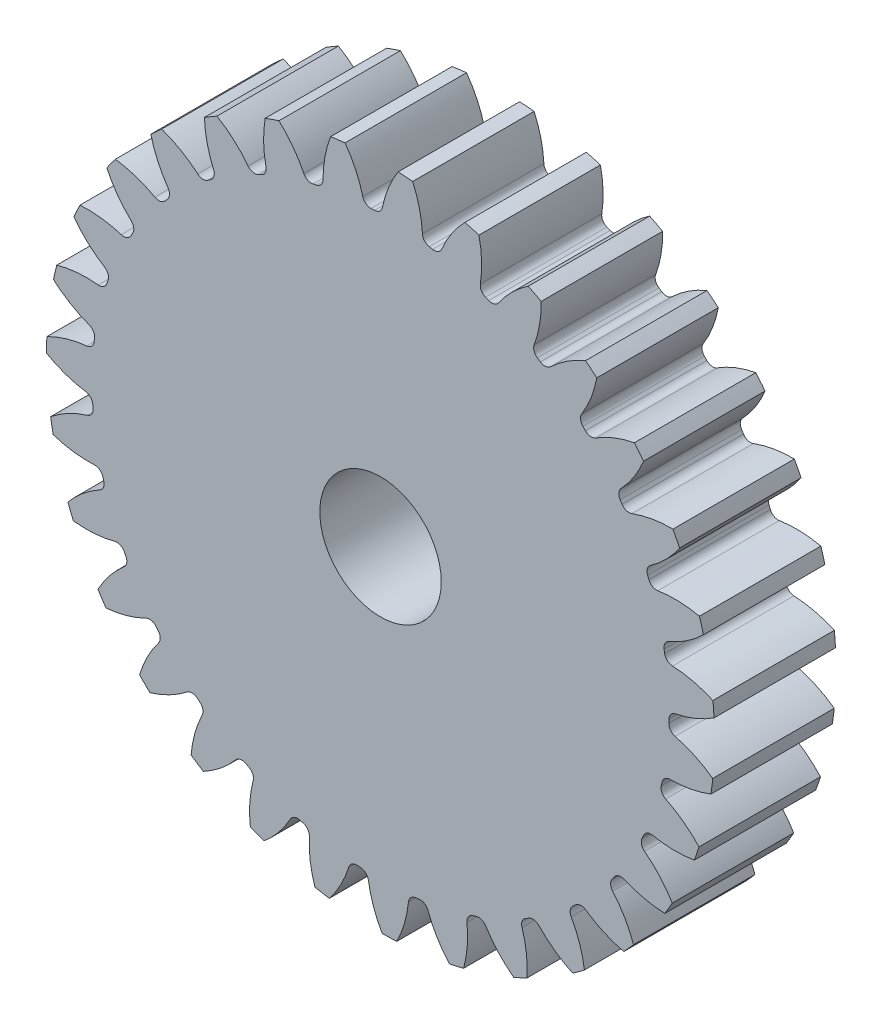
SolidWorks part; units mm, degrees
ref_plane "Front" through (0, 0, 0) normal (0, 0, 1) x (1, 0, 0)
ref_plane "Top" through (0, 0, 0) normal (0, 1, 0) x (1, 0, 0)
ref_plane "Right" through (0, 0, 0) normal (1, 0, 0) x (0, 0, -1)
sketch "Sketch3" plane through (0, 0, 0) normal (0, 0, 1) x (1, 0, 0)
  circle A0 centre (0, 0) radius 279.4
  dimension "od" = 558.8
extrude "gearBody" add sketch "Sketch3" along normal blind 101.6
sketch "Sketch2" plane through (0, 0, 0) normal (0, 0, 1) x (1, 0, 0)
  line L0 (0, 0) -> (227.8638, 94.3843) construction
  line L1 (278.3276, -29.1273) -> (0, 0) construction
  line L2 (0, 0) -> (36.3143, 0) construction
  line L3 (262.3735, 6.9922) -> (261.7415, -19.4974) construction
  line L5 (262.0575, -6.2526) -> (0, 0) construction
  line L7 (0, 0) -> (246.638, 0) construction
  arc A0 (246.6271, 2.3178) -> (246.2359, -14.0773) centre (0, 0) ccw construction
  arc A1 (278.9676, 15.5382) -> (277.9091, -28.8251) centre (0, 0) ccw construction
  arc A2 (262.3735, 6.9922) -> (261.7415, -19.4974) centre (0, 0) ccw construction
  arc A3 (241.1917, -7.2288) -> (241.262, -4.2824) centre (0, 0) ccw
  arc A4 (278.3276, -29.1273) -> (246.3736, -14.1124) centre (223.1031, -105.1442) ccw
  arc A5 (278.3276, -29.1273) -> (279.4, 15.8202) centre (0, 0) ccw
  arc A6 (279.4, 15.8202) -> (246.7663, 2.3463) centre (227.8638, 94.3843) cw
  arc A7 (241.262, -4.2824) -> (246.7663, 2.3463) centre (248.1528, -4.4047) cw
  arc A8 (246.3736, -14.1124) -> (241.1917, -7.2288) centre (248.0805, -7.4353) cw
  point P6 (279.4, 15.8202)
  point P22 (278.3276, -29.1273)
  dimension "baseDia" = 493.276
  dimension "od" = 558.8
  dimension "pd" = 524.9333
  dimension "rd" = 482.6
  dimension "rFillet" = 6.8919
  dimension "pointX" = 279.4
  dimension "pointY" = 15.8202
  dimension "CTT" = 26.4896
  dimension "flankCenterAngle" = 22.5
extrude "toothCut" cut sketch "Sketch2" along normal through all
pattern_circular "CirPattern1" count 31 over 360 about axis through (0, 0, 0) along (0, 0, 1) of "toothCut"
sketch "hub1Dia" plane through (0, 0, 0) normal (0, 0, -1) x (-1, 0, 0)
  circle A0 centre (0, 0) radius 12.7
  dimension "hub1Dia" = 25.4
sketch "hub2Dia" plane through (0, 0, 101.6) normal (0, 0, 1) x (1, 0, 0)
  circle A0 centre (0, 0) radius 12.7
  dimension "hub2dia" = 25.4
sketch "boreDia" plane through (0, 0, 0) normal (0, 0, 1) x (1, 0, 0)
  circle A0 centre (0, 0) radius 50.8
  dimension "boreDia" = 101.6
extrude "bore" cut sketch "boreDia" against normal mid plane 25400
